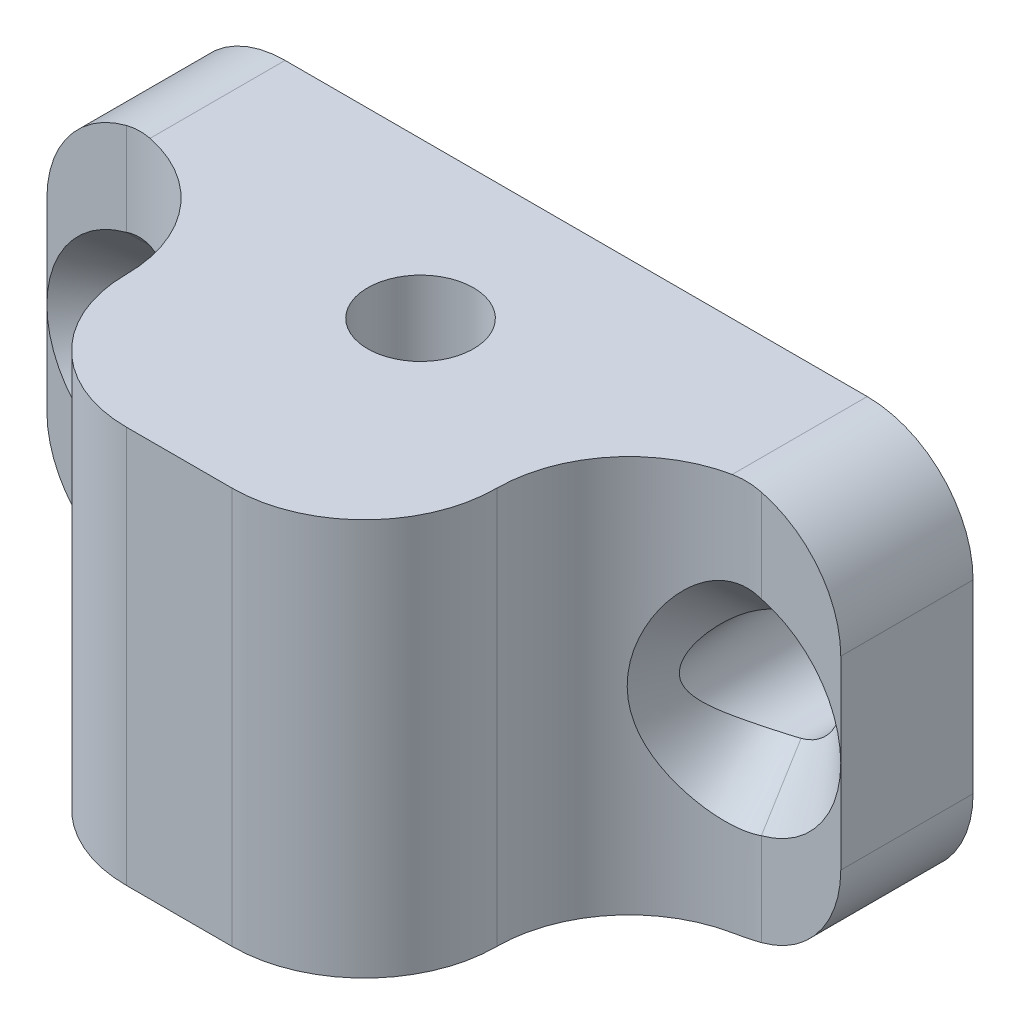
SolidWorks part; units mm, degrees
ref_plane "Plan de face" through (0, 0, 0) normal (0, 0, 1) x (1, 0, 0)
ref_plane "Plan de dessus" through (0, 0, 0) normal (0, 1, 0) x (1, 0, 0)
ref_plane "Plan de droite" through (0, 0, 0) normal (1, 0, 0) x (0, 0, -1)
sketch "Esquisse1" plane through (0, 0, 0) normal (0, 0, 1) x (1, 0, 0)
  line L1 (0, 0) -> (30, 0)
  line L2 (0, 0) -> (0, 15)
  line L3 (0, 15) -> (30, 15)
  line L4 (30, 0) -> (30, 15)
  dimension "D1" = 30
  dimension "D2" = 15
extrude "Boss.-Extru.1" add sketch "Esquisse1" along normal blind 5
sketch "Esquisse2" plane through (0, 0, 5) normal (0, 0, 1) x (1, 0, 0)
  line L0 (30, 15) -> (0, 15) construction
  line L1 (8, 15) -> (22, 15)
  line L2 (8, 15) -> (8, 0)
  line L3 (8, 0) -> (22, 0)
  line L4 (22, 15) -> (22, 0)
  line L5 (0, 0) -> (30, 0) construction
  line L6 (0, 15) -> (0, 0) construction
  line L7 (30, 0) -> (30, 15) construction
  dimension "D1" = 8
  dimension "D2" = 8
extrude "Boss.-Extru.2" add sketch "Esquisse2" along normal blind 10
fillet "Congé1" radius 5 4 edges at (8, 7.5, 5) (22, 7.5, 5) (22, 7.5, 15) (8, 7.5, 15)
sketch "Esquisse3" plane through (0, 0, 0) normal (0, 0, -1) x (-1, 0, 0)
  line L0 (0, 0) -> (-30, 0) construction
  line L2 (0, 15) -> (0, 0) construction
  line L3 (-30, 0) -> (-30, 15) construction
  circle A0 centre (-4, 7.5) radius 2
  circle A1 centre (-26, 7.5) radius 2
  dimension "D1" = 4
  dimension "D2" = 7.5
  dimension "D3" = 4
  dimension "D4" = 4
  dimension "D5" = 4
  dimension "D6" = 7.5
extrude "Enlèv. mat.-Extru.1" cut sketch "Esquisse3" against normal blind 10
chamfer "Chanfrein1" distance 1 4 edges at (2, 7.5, 5) (5.9592, 7.9019, 5.9697) (28, 7.5, 5) (27.9526, 7.9329, 5.0916)
fillet "Congé2" radius 4 4 edges at (0, 0, 2.5) (0, 15, 2.5) (30, 15, 2.5) (30, 0, 2.5)
sketch "Esquisse4" plane through (0, 0, 0) normal (0, -1, 0) x (1, 0, 0)
  line L0 (4, 0) -> (26, 0) construction
  line L1 (4, 5.101) -> (4, 0) construction
  circle A0 centre (15, 5.88) radius 2
  dimension "D1" = 4
  dimension "D2" = 5.88
  dimension "D3" = 11
extrude "Enlèv. mat.-Extru.2" cut sketch "Esquisse4" against normal through all
